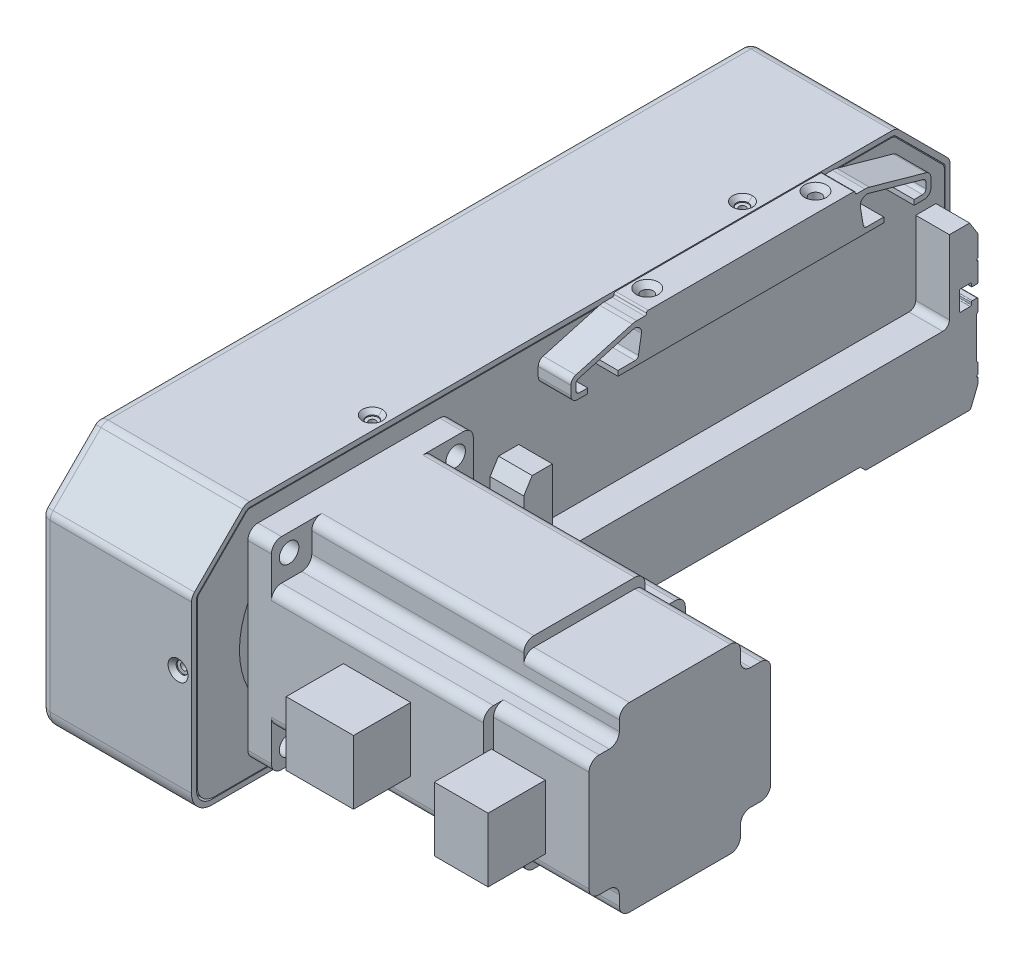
SolidWorks part; units mm, degrees
ref_plane "前视基准面" through (0, 0, 0) normal (0, 0, 1) x (1, 0, 0)
ref_plane "上视基准面" through (0, 0, 0) normal (0, 1, 0) x (1, 0, 0)
ref_plane "右视基准面" through (0, 0, 0) normal (1, 0, 0) x (0, 0, -1)
imported_body "输入1"
imported_body "输入2"
sketch "草图1" plane through (0, 73.5, 0) normal (0, 1, 0) x (1, 0, 0)
  line L0 (-339, 57) -> (-339, -57) construction
  line L1 (355.8293, 136.3376) -> (-329, 136.3376)
  line L2 (355.8293, 136.3376) -> (355.8293, -72.7504)
  line L3 (355.8293, -72.7504) -> (-329, -72.7504)
  line L4 (-329, 136.3376) -> (-329, -72.7504)
  dimension "D1" = 10
extrude "切除-拉伸1" cut sketch "草图1" against normal up to surface (73.5 mm away)
